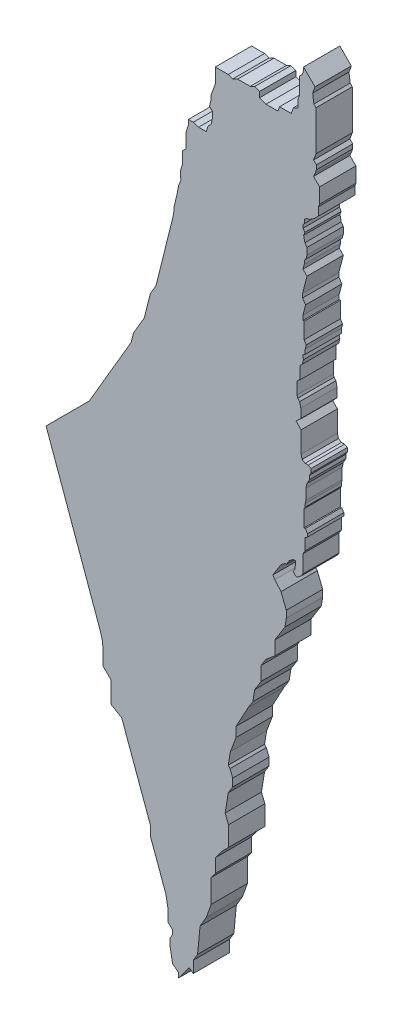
SolidWorks part; units mm, degrees
ref_plane "Front Plane" through (0, 0, 0) normal (0, 0, 1) x (1, 0, 0)
ref_plane "Top Plane" through (0, 0, 0) normal (0, 1, 0) x (1, 0, 0)
ref_plane "Right Plane" through (0, 0, 0) normal (1, 0, 0) x (0, 0, -1)
sketch "Sketch2" plane through (0, 0, 0) normal (0, 0, 1) x (1, 0, 0)
  line L0 (61.4853, 360.226) -> (280.8186, 360.226) construction
  line L1 (-16.3117, 33.0883) -> (-11.8176, 20.6225)
  line L2 (-11.6128, 19.4506) -> (-11.6128, 18.2684)
  line L3 (-11.6128, 18.2684) -> (-10.9662, 17.6218)
  line L4 (-10.9662, 17.6218) -> (-10.9662, 16.8774)
  line L5 (-10.9662, 16.8774) -> (-10.9662, 16.3424)
  line L6 (-10.9662, 16.3424) -> (-10.9662, 15.8609)
  line L7 (-10.9662, 15.8609) -> (-10.0619, 15.3275)
  line L8 (-10.0619, 15.3275) -> (-8.972, 12.3409)
  line L9 (-8.972, 12.3409) -> (-7.6985, 8.8513)
  line L10 (-7.6985, 8.8513) -> (-7.6985, 8.0583)
  line L11 (-7.6985, 8.0583) -> (-6.4133, 4.5364)
  line L12 (-6.4133, 4.5364) -> (-6.258, 3.6711)
  line L13 (-6.258, 3.6711) -> (-6.258, 2.6466)
  line L14 (-6.258, 2.6466) -> (-5.8555, 2.2441)
  line L15 (-5.8555, 2.2441) -> (-5.8555, 1.9392)
  line L16 (-5.8555, 1.9392) -> (-6.0568, 1.598)
  line L17 (-6.0568, 1.598) -> (-6.0568, 0.9391)
  line L19 (-6.0568, 0.9391) -> (-5.8555, -0.182)
  line L20 (-5.8555, -0.182) -> (-5.6238, -0.3537)
  line L21 (-5.6238, -0.3537) -> (-5.3654, -0.5452)
  line L22 (-5.3654, -0.5452) -> (-5.3654, -0.9392)
  line L23 (-5.3654, -0.9392) -> (-4.8679, -0.2679)
  line L24 (-4.8679, -0.2679) -> (-4.4909, 0.2409)
  line L25 (-4.4909, 0.2409) -> (-4.1476, -0.0135)
  line L26 (-4.1476, -0.0135) -> (-4.1476, 0.9391)
  line L27 (-4.1476, 0.9391) -> (-3.7997, 1.5289)
  line L28 (-3.7997, 1.5289) -> (-3.709, 2.4454)
  line L29 (-3.709, 2.4454) -> (-3.6615, 2.9259)
  line L30 (-3.6615, 2.9259) -> (-3.5878, 3.6711)
  line L31 (-3.5878, 3.6711) -> (-3.0774, 4.5364)
  line L32 (-3.0774, 4.5364) -> (-2.6722, 5.6714)
  line L33 (-2.6722, 5.6714) -> (-2.6722, 7.5984)
  line L34 (-2.6722, 7.5984) -> (-2.3314, 8.0583)
  line L35 (-2.3314, 8.0583) -> (-2.3314, 9.184)
  line L36 (-2.3314, 9.184) -> (-1.7939, 9.9094)
  line L37 (-1.7939, 9.9094) -> (-1.2379, 10.4654)
  line L38 (-1.2379, 10.4654) -> (-1.2379, 11.2563)
  line L39 (-1.2379, 11.2563) -> (-1.2379, 12.0909)
  line L40 (-1.2379, 12.0909) -> (-1.5159, 12.7896)
  line L41 (-1.5159, 12.7896) -> (-1.3769, 13.6436)
  line L42 (-1.3769, 13.6436) -> (-1.2579, 14.3743)
  line L43 (-1.2579, 14.3743) -> (-0.8895, 14.9634)
  line L44 (-0.8895, 14.9634) -> (-0.8895, 15.6039)
  line L45 (-0.8895, 15.6039) -> (-1.1146, 16.1697)
  line L46 (-1.1146, 16.1697) -> (-1.2579, 16.3424)
  line L47 (-1.2579, 16.3424) -> (-1.0871, 17.3915)
  line L48 (-1.0871, 17.3915) -> (-0.6095, 18.6456)
  line L49 (-0.6095, 18.6456) -> (-0.6095, 19.4506)
  line L50 (-0.6095, 19.4506) -> (0.3688, 21.2565)
  line L51 (0.3688, 21.2565) -> (0.7696, 21.8972)
  line L52 (0.7696, 21.8972) -> (0.9233, 22.8413)
  line L53 (0.9233, 22.8413) -> (1.4587, 23.6973)
  line L54 (1.4587, 23.6973) -> (1.4587, 24.8409)
  line L55 (1.4587, 24.8409) -> (1.8589, 25.4807)
  line L56 (1.8589, 25.4807) -> (2.588, 26.0857)
  line L57 (2.588, 26.0857) -> (2.588, 27.2286)
  line L58 (2.588, 27.2286) -> (3.4259, 28.5682)
  line L59 (3.4259, 28.5682) -> (3.5381, 29.2575)
  line L60 (3.5381, 29.2575) -> (3.5381, 29.8253)
  line L61 (3.5381, 29.8253) -> (3.3013, 30.4205)
  line L62 (3.3013, 30.4205) -> (3.0964, 30.9354)
  line L63 (3.0964, 30.9354) -> (2.588, 31.5481)
  line L64 (2.588, 31.5481) -> (2.4152, 31.7817)
  line L65 (2.4152, 31.7817) -> (2.8422, 32.4644)
  line L66 (2.8422, 32.4644) -> (3.0964, 32.8708)
  line L67 (3.0964, 32.8708) -> (3.4197, 33.11)
  line L68 (3.4197, 33.11) -> (3.5381, 33.11)
  line L69 (3.5381, 33.11) -> (3.7873, 33.5084)
  line L70 (3.7873, 33.5084) -> (4.1042, 33.7429)
  line L71 (4.1042, 33.7429) -> (4.2862, 33.7429)
  line L72 (4.2862, 33.7429) -> (4.2862, 33.4142)
  line L73 (4.2862, 33.4142) -> (4.2367, 33.11)
  line L74 (4.2367, 33.11) -> (4.1042, 32.8982)
  line L75 (4.1042, 32.8982) -> (4.2748, 32.6676)
  line L76 (4.2748, 32.6676) -> (4.4279, 32.6427)
  line L77 (4.4279, 32.6427) -> (4.6174, 32.7829)
  line L78 (4.6174, 32.7829) -> (4.7732, 32.8982)
  line L79 (4.7732, 32.8982) -> (4.9057, 33.11)
  line L80 (4.9057, 33.11) -> (4.9057, 33.4142)
  line L81 (4.9057, 33.4142) -> (4.9057, 33.7429)
  line L82 (4.9057, 33.7429) -> (4.9057, 34.2076)
  line L83 (4.9057, 34.2076) -> (4.9057, 34.5504)
  line L84 (4.9057, 34.5504) -> (5.0988, 34.859)
  line L85 (5.0988, 34.859) -> (5.0988, 35.1149)
  line L86 (5.0988, 35.1149) -> (5.0988, 35.4979)
  line L87 (5.0988, 35.4979) -> (5.0988, 35.8004)
  line L88 (5.0988, 35.8004) -> (5.2942, 35.9415)
  line L89 (5.2942, 35.9415) -> (5.2942, 36.1834)
  line L90 (5.2942, 36.1834) -> (5.0988, 36.4541)
  line L91 (5.0988, 36.4541) -> (5.0022, 36.4541)
  line L92 (5.0022, 36.4541) -> (5.0022, 37.8165)
  line L94 (5.0988, 37.9868) -> (5.0988, 38.0185)
  line L95 (5.0988, 38.0185) -> (5.0988, 38.2409)
  line L96 (5.0988, 38.2409) -> (5.1547, 38.4871)
  line L97 (5.0022, 37.8165) -> (5.0988, 37.9868)
  line L98 (5.1547, 38.4871) -> (5.1547, 39.3668)
  line L99 (5.1547, 39.3668) -> (5.2408, 39.7454)
  line L100 (5.2408, 39.7454) -> (5.4565, 40.1257)
  line L101 (5.4565, 40.1257) -> (5.4565, 40.4472)
  line L102 (5.4565, 40.4472) -> (5.5752, 40.6567)
  line L103 (5.5752, 40.6567) -> (5.5752, 40.9874)
  line L104 (5.5752, 40.9874) -> (5.3486, 41.1158)
  line L105 (5.3486, 41.1158) -> (5.0988, 41.1158)
  line L106 (5.0988, 41.1158) -> (4.8394, 41.2629)
  line L146 (-16.3117, 33.0883) -> (-13.902, 35.4979)
  line L147 (-13.902, 35.4979) -> (-12.7434, 36.6565)
  line L148 (-12.7434, 36.6565) -> (-11.8176, 38.2409)
  line L149 (-11.8176, 38.2409) -> (-10.9662, 39.6979)
  line L151 (-10.9662, 39.6979) -> (-10.3377, 40.7733)
  line L152 (-10.3377, 40.7733) -> (-9.8541, 41.601)
  line L153 (-9.8541, 41.601) -> (-9.285, 42.5749)
  line L154 (-9.285, 42.5749) -> (-9.0917, 43.3478)
  line L155 (-9.0917, 43.3478) -> (-8.6247, 44.1469)
  line L156 (-8.6247, 44.1469) -> (-8.1931, 44.8856)
  line L157 (-8.1931, 44.8856) -> (-7.9958, 45.6743)
  line L158 (-7.9958, 45.6743) -> (-7.6985, 46.863)
  line L159 (-7.6985, 46.863) -> (-7.2312, 47.6629)
  line L160 (-7.2312, 47.6629) -> (-6.8767, 49.0802)
  line L161 (-6.8767, 49.0802) -> (-6.4663, 50.7213)
  line L162 (-6.4663, 50.7213) -> (-6.1065, 52.16)
  line L163 (-6.1065, 52.16) -> (-5.8555, 53.1635)
  line L164 (-5.7276, 54.1113) -> (-5.5074, 54.9917)
  line L165 (-5.5074, 54.9917) -> (-5.3665, 55.7495)
  line L168 (-5.1605, 56.2757) -> (-5.2045, 56.4078)
  line L169 (-5.2045, 56.4078) -> (-5.2045, 56.9142)
  line L170 (-5.2045, 56.9142) -> (-5.0337, 57.4731)
  line L171 (-5.0337, 57.4731) -> (-5.0337, 58.0593)
  line L172 (-5.0337, 58.0593) -> (-5.0337, 58.4116)
  line L173 (-5.0337, 58.4116) -> (-4.7448, 58.7005)
  line L174 (-4.7448, 58.7005) -> (-4.7448, 59.2263)
  line L175 (-4.7448, 59.2263) -> (-4.7448, 59.8869)
  line L176 (-4.7448, 59.8869) -> (-4.5529, 60.5147)
  line L177 (-4.5529, 60.5147) -> (-4.5529, 60.8998)
  line L178 (-4.5529, 60.8998) -> (-4.1476, 60.8998)
  line L179 (-4.1476, 60.8998) -> (-3.709, 60.7658)
  line L180 (-3.709, 60.7658) -> (-3.5878, 60.7658)
  line L181 (-3.5878, 60.7658) -> (-3.0774, 60.7658)
  line L182 (-3.0774, 60.7658) -> (-2.9361, 61.2281)
  line L183 (-5.3665, 55.7495) -> (-5.1605, 56.2757)
  line L184 (-2.9361, 61.2281) -> (-2.6722, 61.4921)
  line L185 (-2.6722, 61.4921) -> (-2.5653, 61.9915)
  line L186 (-2.5653, 61.9915) -> (-2.5653, 62.4616)
  line L187 (-2.5653, 62.4616) -> (-2.8042, 62.7004)
  line L188 (-2.8042, 62.7004) -> (-2.7041, 63.1681)
  line L189 (-2.7041, 63.1681) -> (-2.7041, 63.5193)
  line L190 (-2.7041, 63.5193) -> (-2.5653, 63.9013)
  line L191 (-2.5653, 63.9013) -> (-2.3314, 64.5452)
  line L192 (-2.3314, 64.5452) -> (-2.3314, 64.9049)
  line L193 (-2.3314, 64.9049) -> (-2.3314, 65.3856)
  line L194 (-2.3314, 65.3856) -> (-2.3314, 65.7618)
  line L195 (-2.3314, 65.7618) -> (-1.6622, 65.7618)
  line L196 (-1.6622, 65.7618) -> (-1.2579, 65.7618)
  line L197 (-1.2579, 65.7618) -> (-0.8895, 65.628)
  line L198 (-0.8895, 65.628) -> (-0.4864, 65.8162)
  line L199 (-0.4864, 65.8162) -> (-0.2618, 65.8162)
  line L200 (-0.2618, 65.8162) -> (0.1563, 65.8162)
  line L201 (0.1563, 65.8162) -> (0.5505, 65.8162)
  line L202 (0.5505, 65.8162) -> (0.9233, 65.9903)
  line L203 (0.9233, 65.9903) -> (1.3279, 65.8434)
  line L204 (1.3279, 65.8434) -> (1.3279, 65.3856)
  line L205 (1.3279, 65.3856) -> (1.6575, 65.2659)
  line L206 (1.6575, 65.2659) -> (1.8589, 65.1927)
  line L207 (1.8589, 65.1927) -> (2.3466, 65.1927)
  line L208 (2.3466, 65.1927) -> (2.8422, 65.1927)
  line L209 (2.8422, 65.1927) -> (2.9806, 65.5737)
  line L210 (2.9806, 65.5737) -> (3.4789, 65.5737)
  line L211 (3.4789, 65.5737) -> (3.9458, 65.5737)
  line L212 (3.9458, 65.5737) -> (4.1267, 66.0718)
  line L213 (4.1267, 66.0718) -> (4.4904, 66.2417)
  line L214 (4.4904, 66.2417) -> (4.4904, 66.8278)
  line L215 (4.4904, 66.8278) -> (4.6174, 67.1775)
  line L216 (4.6174, 67.1775) -> (4.6174, 67.3406)
  line L217 (4.6174, 67.3406) -> (4.6174, 67.624)
  line L218 (4.6174, 67.624) -> (4.6174, 68.0491)
  line L219 (4.6174, 68.0491) -> (4.6174, 68.3325)
  line L220 (4.6174, 68.3325) -> (4.6174, 68.5805)
  line L221 (4.6174, 68.5805) -> (4.8394, 68.8025)
  line L222 (4.8394, 68.8025) -> (4.9582, 69.1295)
  line L223 (4.9582, 69.1295) -> (4.9582, 69.4071)
  line L224 (4.9582, 69.4071) -> (5.3486, 69.0166)
  line L225 (5.3486, 69.0166) -> (5.7471, 68.6182)
  line L226 (5.7471, 68.6182) -> (5.9088, 68.4565)
  line L227 (5.9088, 68.4565) -> (5.8279, 68.2339)
  line L228 (5.8279, 68.2339) -> (5.7161, 67.9259)
  line L229 (5.7161, 67.9259) -> (5.772, 67.4823)
  line L230 (5.772, 67.4823) -> (5.8104, 67.1775)
  line L231 (5.8104, 67.1775) -> (5.9853, 67.0027)
  line L232 (5.9853, 67.0027) -> (5.9853, 66.6806)
  line L233 (5.9853, 66.6806) -> (5.9853, 66.2848)
  line L234 (5.9853, 66.2848) -> (5.9853, 65.8228)
  line L235 (5.9853, 65.8228) -> (5.9853, 65.5737)
  line L236 (5.9853, 65.5737) -> (5.9853, 65.1927)
  line L237 (5.9853, 65.1927) -> (5.9853, 65.0248)
  line L238 (5.9853, 65.0248) -> (5.9853, 64.8329)
  line L239 (5.9853, 64.8329) -> (5.9853, 64.4823)
  line L240 (5.9853, 64.4823) -> (5.9853, 64.0511)
  line L241 (5.9853, 64.0511) -> (5.9853, 63.7103)
  line L242 (5.9853, 63.7103) -> (5.7883, 63.1681)
  line L243 (5.7883, 63.1681) -> (6.0222, 62.9343)
  line L244 (6.0222, 62.9343) -> (6.0222, 62.581)
  line L245 (6.0222, 62.581) -> (5.9063, 62.262)
  line L246 (5.9063, 62.262) -> (5.7883, 61.9915)
  line L247 (5.7883, 61.9915) -> (6.038, 61.7418)
  line L248 (6.038, 61.7418) -> (6.2877, 61.4921)
  line L249 (6.2877, 61.4921) -> (6.2877, 61.2281)
  line L250 (6.2877, 61.2281) -> (6.2877, 60.7658)
  line L251 (6.2877, 60.7658) -> (6.2877, 60.2532)
  line L252 (6.2877, 60.2532) -> (6.1946, 60.0218)
  line L253 (6.1946, 60.0218) -> (6.1946, 59.7883)
  line L254 (6.1946, 59.7883) -> (6.1946, 59.5548)
  line L255 (6.1946, 59.5548) -> (6.1946, 59.3547)
  line L256 (6.1946, 59.3547) -> (6.038, 59.1981)
  line L257 (6.038, 59.1981) -> (5.8499, 59.01)
  line L258 (5.8499, 59.01) -> (5.7161, 58.921)
  line L259 (5.7161, 58.921) -> (5.4565, 58.7484)
  line L260 (5.4565, 58.7484) -> (5.2408, 58.7005)
  line L261 (5.2408, 58.7005) -> (5.0277, 58.5588)
  line L262 (5.0277, 58.5588) -> (5.0277, 58.2316)
  line L263 (5.0277, 58.2316) -> (4.9217, 58.1256)
  line L264 (4.9217, 58.1256) -> (4.9217, 57.8535)
  line L265 (4.9217, 57.8535) -> (5.0719, 57.6276)
  line L266 (5.0719, 57.6276) -> (4.9658, 57.3642)
  line L267 (4.9658, 57.3642) -> (5.0719, 56.8869)
  line L268 (5.0719, 56.8869) -> (5.2408, 56.6327)
  line L269 (5.2408, 56.6327) -> (5.2408, 56.0774)
  line L270 (5.2408, 56.0774) -> (5.1564, 55.7495)
  line L271 (5.1564, 55.7495) -> (5.0189, 55.612)
  line L272 (5.0189, 55.612) -> (5.0189, 55.3217)
  line L273 (5.0189, 55.3217) -> (4.915, 54.9185)
  line L274 (4.915, 54.9185) -> (5.2474, 54.5861)
  line L275 (5.2474, 54.5861) -> (5.1251, 54.1113)
  line L276 (5.1251, 54.1113) -> (4.9884, 53.5806)
  line L277 (4.9884, 53.5806) -> (4.8809, 53.1635)
  line L278 (4.8809, 53.1635) -> (4.8809, 52.8386)
  line L279 (4.8809, 52.8386) -> (5.1268, 52.4687)
  line L280 (5.1268, 52.4687) -> (5.0039, 51.9913)
  line L281 (5.0039, 51.9913) -> (4.9078, 51.6185)
  line L282 (4.9078, 51.6185) -> (4.9078, 51.2391)
  line L283 (4.9078, 51.2391) -> (5.0039, 51.2391)
  line L284 (5.0039, 51.2391) -> (5.0039, 51.0064)
  line L285 (5.0039, 51.0064) -> (5.0039, 50.7213)
  line L286 (5.0039, 50.7213) -> (5.0039, 50.5078)
  line L287 (5.0039, 50.5078) -> (5.0039, 50.2087)
  line L288 (5.0039, 50.2087) -> (5.0039, 49.9095)
  line L289 (5.0039, 49.9095) -> (5.1862, 49.6352)
  line L290 (5.1862, 49.6352) -> (5.095, 49.2812)
  line L291 (5.095, 49.2812) -> (5.095, 48.9124)
  line L292 (5.095, 48.9124) -> (4.8856, 48.7731)
  line L293 (4.8856, 48.7731) -> (4.9558, 48.4571)
  line L294 (4.9558, 48.4571) -> (4.862, 48.0927)
  line L295 (4.862, 48.0927) -> (4.659, 47.8898)
  line L296 (4.659, 47.8898) -> (4.659, 47.6629)
  line L297 (4.659, 47.6629) -> (4.659, 47.2882)
  line L298 (4.659, 47.2882) -> (4.659, 47.1027)
  line L299 (4.659, 47.1027) -> (4.659, 46.863)
  line L300 (4.659, 46.863) -> (4.6174, 46.863)
  line L301 (4.6174, 46.863) -> (4.4279, 46.6735)
  line L302 (4.4279, 46.6735) -> (4.4279, 46.3129)
  line L303 (4.4279, 46.3129) -> (4.4279, 46.0126)
  line L304 (4.4279, 46.0126) -> (4.4279, 45.6743)
  line L305 (4.4279, 45.6743) -> (4.475, 45.4623)
  line L306 (4.475, 45.4623) -> (4.6382, 45.299)
  line L307 (4.6382, 45.299) -> (4.7301, 44.8856)
  line L308 (4.7301, 44.8856) -> (4.7301, 44.5289)
  line L309 (4.7301, 44.5289) -> (4.7301, 44.1469)
  line L310 (4.6382, 44.055) -> (4.3452, 43.7621)
  line L311 (4.3452, 43.7621) -> (4.7595, 43.3478)
  line L312 (4.7595, 43.3478) -> (4.7595, 43.1491)
  line L313 (4.7595, 43.1491) -> (4.7595, 42.8766)
  line L314 (4.7595, 42.8766) -> (4.7595, 42.5749)
  line L315 (4.7595, 42.5749) -> (4.7595, 42.3013)
  line L316 (4.7595, 42.3013) -> (4.7595, 42.0288)
  line L317 (4.7595, 42.0288) -> (4.7595, 41.7866)
  line L318 (4.7595, 41.7866) -> (4.7595, 41.601)
  line L319 (4.7595, 41.601) -> (4.8394, 41.2629)
  arc A0 (-11.8176, 20.6225) -> (-11.6128, 19.4506) centre (-15.0681, 19.4506) cw
  arc A1 (-5.8555, 53.1635) -> (-5.7276, 54.1113) centre (-10.0473, 54.2118) ccw
  arc A2 (4.7301, 44.1469) -> (4.6382, 44.055) centre (4.6382, 44.1469) cw
extrude "Boss-Extrude1" add sketch "Sketch2" along direction (0, 0, 1) on the side of the normal blind 3
scale "Scale1" bodies to scale 101 scale about centroid uniform scaling yes scale factor 1.5
scale "Scale2" bodies to scale 104 scale about centroid uniform scaling yes scale factor 1.5
